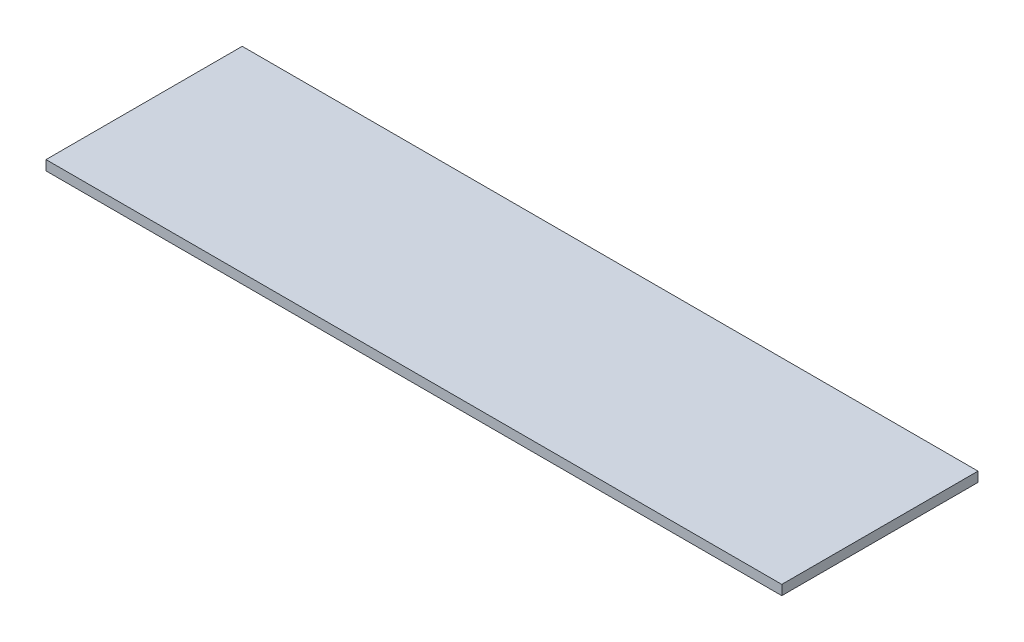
SolidWorks part; units mm, degrees
ref_plane "Plan de face" through (0, 0, 0) normal (0, 0, 1) x (1, 0, 0)
ref_plane "Plan de dessus" through (0, 0, 0) normal (0, 1, 0) x (1, 0, 0)
ref_plane "Plan de droite" through (0, 0, 0) normal (1, 0, 0) x (0, 0, -1)
sketch "Esquisse1" plane through (0, 0, 0) normal (0, 1, 0) x (1, 0, 0)
  line L1 (0, 0) -> (75, 0)
  line L2 (0, 0) -> (0, 20)
  line L3 (0, 20) -> (75, 20)
  line L4 (75, 0) -> (75, 20)
extrude "Extrusion1" add sketch "Esquisse1" along normal blind 1
